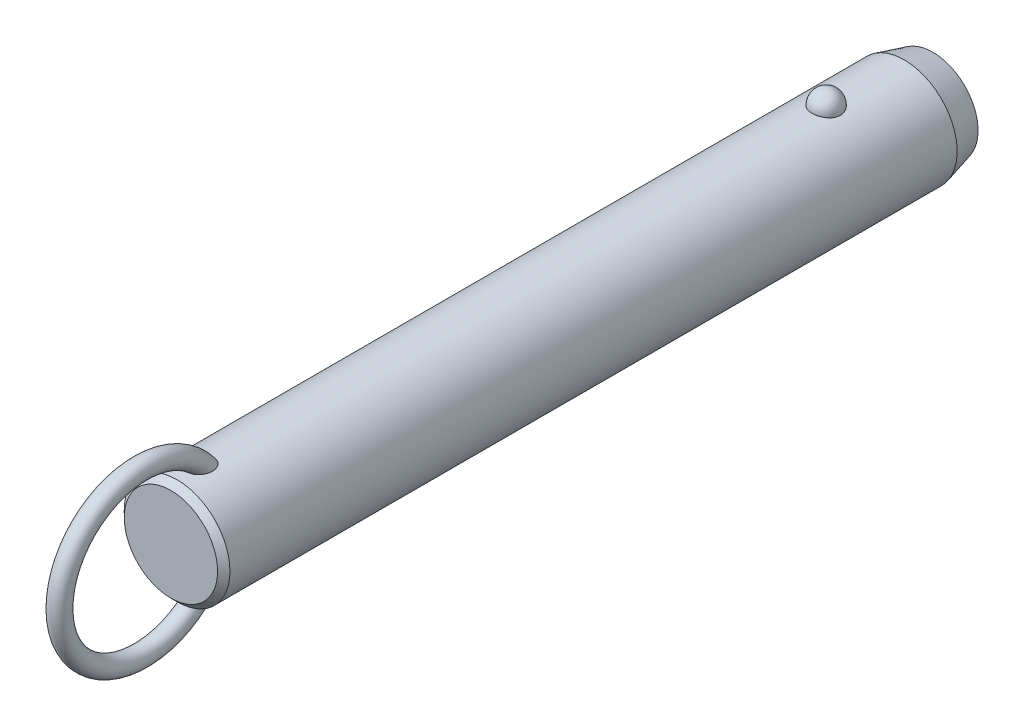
SolidWorks part; units mm, degrees
ref_plane "Front Plane" through (0, 0, 0) normal (0, 0, 1) x (1, 0, 0)
ref_plane "Top Plane" through (0, 0, 0) normal (0, 1, 0) x (1, 0, 0)
ref_plane "Right Plane" through (0, 0, 0) normal (1, 0, 0) x (0, 0, -1)
sketch "Sketch2" plane through (0, 0, 0) normal (0, 0, 1) x (1, 0, 0)
  circle A0 centre (0, 0) radius 11.1
  point P3 (0, 11.1)
  dimension "D1" = 22.2
extrude "Boss-Extrude1" add sketch "Sketch2" along normal blind 121.9
sketch "Sketch3" plane through (0, 0, 0) normal (0, 0, -1) x (-1, 0, 0)
  circle A0 centre (0, 0) radius 11.1
  dimension "D1" = 22.2
extrude "Boss-Extrude2" add sketch "Sketch3" along normal blind 25.4
chamfer "Chamfer1" distance 6 angle 15 1 edges at (-11.1, 0, -25.4)
sketch "Sketch12" plane through (0, 0, 0) normal (1, 0, 0) x (0, 0, -1)
  line L0 (-121.9, 11.1) -> (-121.9, -11.1) construction
  point P0 (-121.9, 0)
sketch "Sketch13" plane through (0, 0, 0) normal (1, 0, 0) x (0, 0, -1)
  circle A0 centre (-140.95, 0) radius 19.05
  point P2 (-121.9, 0)
  dimension "D1" = 38.1
sketch "Sketch14" plane through (0, 0, 0) normal (0, 1, 0) x (1, 0, 0)
  circle A0 centre (0, -123.9) radius 2
  point P2 (0, -121.9)
  dimension "D1" = 4
sweep "Sweep1" add profiles "Sketch14" path "Sketch13"
sketch "Sketch15" plane through (0, 0, 121.9) normal (0, 0, 1) x (1, 0, 0)
  circle A0 centre (0, 0) radius 11.1
  dimension "D1" = 22.2
extrude "Boss-Extrude3" add sketch "Sketch15" along normal blind 12.7
chamfer "Chamfer2" distance 1.3 angle 45 1 edges at (11.1, 0, 134.6)
sketch "Sketch18" plane through (0, 0, 0) normal (1, 0, 0) x (0, 0, -1)
  line L0 (19.4, 11.1) -> (-125.468, 11.1) construction
  line L1 (3, 14.1) -> (3, 8.1)
  line L2 (-125.468, -11.1) -> (19.4, -11.1) construction
  arc A0 (3, 14.1) -> (3, 8.1) centre (3, 11.1) ccw
  point P4 (0, 11.1)
  dimension "D1" = 25.2
revolve "Revolve1" add sketch "Sketch18" angle 360 about L1
